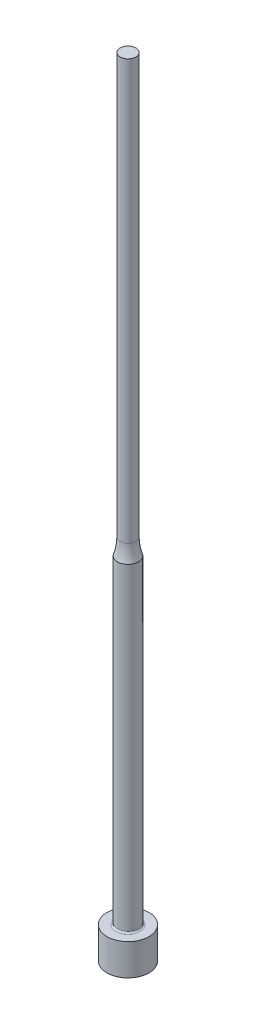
SolidWorks part; units mm, degrees
ref_plane "Front Plane" through (0, 0, 0) normal (0, 0, 1) x (1, 0, 0)
ref_plane "Top Plane" through (0, 0, 0) normal (0, 1, 0) x (1, 0, 0)
ref_plane "Right Plane" through (0, 0, 0) normal (1, 0, 0) x (0, 0, -1)
sketch "Sketch1" plane through (0, 0, 0) normal (0, 0, 1) x (1, 0, 0)
  line L0 (0, 0) -> (4, 0)
  line L1 (55, 0) -> (-55, 0) construction
  line L2 (4, 0) -> (4, 6)
  line L3 (4, 6) -> (2.3, 6)
  line L4 (2, 6.3) -> (2, 66.8775)
  line L6 (1.5, 70) -> (1.5, 150)
  line L7 (1.5, 150) -> (0, 150)
  line L8 (0, 150) -> (0, 0)
  arc A0 (1.5, 70) -> (2, 66.8775) centre (11.5, 70) ccw
  arc A1 (2.3, 6) -> (2, 6.3) centre (2.3, 6.3) cw
  dimension "D7" = 70
  dimension "D8" = 0.3
  dimension "D5" = 10
  dimension "D1" = 1.5
  dimension "D2" = 2
  dimension "D3" = 4
  dimension "D4" = 6
  dimension "D6" = 150
revolve "Revolve1" add sketch "Sketch1" angle 360 about L8
